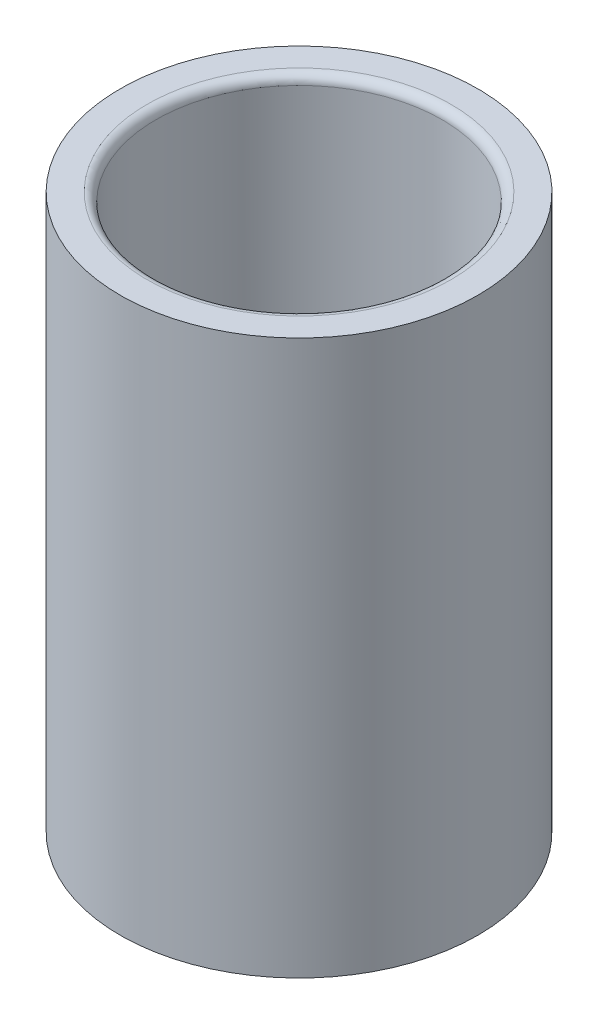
SolidWorks part; units mm, degrees
ref_plane "Front Plane" through (0, 0, 0) normal (0, 0, 1) x (1, 0, 0)
ref_plane "Top Plane" through (0, 0, 0) normal (0, 1, 0) x (1, 0, 0)
ref_plane "Right Plane" through (0, 0, 0) normal (1, 0, 0) x (0, 0, -1)
sketch "Sketch1" plane through (0, 0, 0) normal (0, 0, 1) x (1, 0, 0)
  line L0 (-25.4064, 98.425) -> (-25.4063, 0)
  line L1 (-25.4063, 0) -> (-31.7564, 0)
  line L2 (-31.7564, 0) -> (-31.7564, 98.425)
  line L3 (-31.7564, 98.425) -> (-25.4064, 98.425)
  line L4 (0, -1000) -> (0, 49000) construction
  dimension "OD" = 63.5127
  dimension "ID" = 50.8127
  dimension "Length" = 98.425
revolve "Revolve1" add sketch "Sketch1" angle 360 about L4
fillet "Fillet1" radius 1.5748 1 edges at (25.4063, 98.425, 0)
chamfer "Chamfer1" distance 1.524 angle 45 1 edges at (25.4063, 0, 0)
